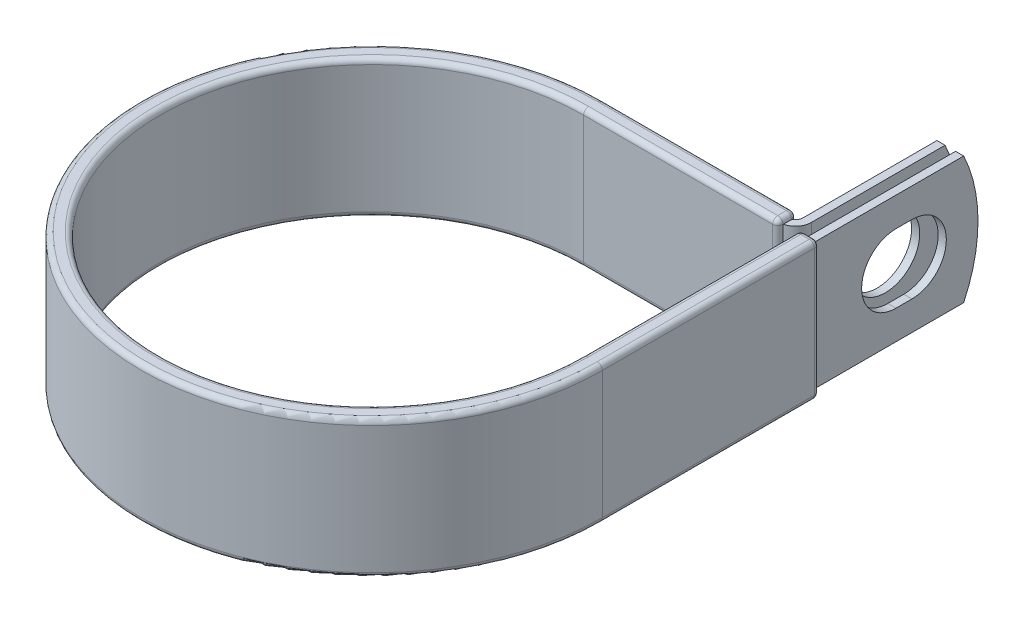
SolidWorks part; units mm, degrees
ref_plane "Front Plane" through (0, 0, 0) normal (0, 0, 1) x (1, 0, 0)
ref_plane "Top Plane" through (0, 0, 0) normal (0, 1, 0) x (1, 0, 0)
ref_plane "Right Plane" through (0, 0, 0) normal (1, 0, 0) x (0, 0, -1)
sketch "Sketch1" plane through (0, 0, 0) normal (0, 1, 0) x (1, 0, 0)
  line L0 (0, 32.5437) -> (28.5915, 32.5437)
  line L1 (32.5437, 0) -> (32.5437, 32.5437)
  line L2 (30.9689, 57.1246) -> (30.9689, 34.9212)
  line L5 (32.5437, 32.5437) -> (32.5437, 57.1246)
  arc A0 (0, 32.5437) -> (32.5437, 0) centre (0, 0) ccw
  arc A3 (28.5915, 32.5437) -> (30.9689, 34.9212) centre (28.5915, 34.9212) ccw
extrude "Extrude-Thin1" add sketch "Sketch1" along normal mid plane 19.05 thin
sketch "Sketch2" plane through (29.7498, 0, 0) normal (-1, 0, 0) x (0, 0, 1)
  line L0 (-57.1246, 9.525) -> (-57.1246, -9.525) construction
  line L7 (0, 9.525) -> (0, -9.525) construction
  circle A0 centre (-46.0248, 0) radius 5.1562
  point P2 (-57.1246, 0)
extrude "Cut-Extrude1" cut sketch "Sketch2" against normal up to surface (1.2192 mm away)
sketch "Sketch3" plane through (33.7629, 0, 0) normal (1, 0, 0) x (0, 0, -1)
  line L0 (44.831, 0) -> (47.2186, 0) construction
  line L1 (44.831, 5.1562) -> (47.2186, 5.1562)
  line L2 (44.831, -5.1562) -> (47.2186, -5.1562)
  line L3 (57.1246, 9.525) -> (57.1246, -9.525) construction
  arc A0 (44.831, 5.1562) -> (44.831, -5.1562) centre (44.831, 0) ccw
  arc A1 (47.2186, -5.1562) -> (47.2186, 5.1562) centre (47.2186, 0) ccw
  point P3 (46.0248, 0)
  point P8 (57.1246, 0)
  point P11 (39.6748, 0)
  point P12 (52.3748, 0)
extrude "Cut-Extrude2" cut sketch "Sketch3" against normal up to surface (1.2192 mm away)
sketch "Sketch4" plane through (29.7498, 0, 0) normal (-1, 0, 0) x (0, 0, 1)
  line L0 (-57.1246, 9.525) -> (-57.1246, -9.525)
  line L1 (-57.1246, 9.525) -> (-54.9801, 9.525)
  line L2 (-57.1246, 9.525) -> (-34.9212, 9.525) construction
  line L3 (-57.1246, -9.525) -> (-54.9801, -9.525)
  line L4 (-57.1246, -9.525) -> (-34.9212, -9.525) construction
  arc A0 (-54.9801, 9.525) -> (-54.9801, -9.525) centre (-34.8996, 0) ccw
extrude "Cut-Extrude3" cut sketch "Sketch4" against normal through all contours A0 M4 M5 | A0 L0 M2
ref_plane "Plane1" through (0, 0, -32.5437) normal (0, 0, 1) x (1, 0, 0)
ref_plane "Plane2" through (0, 0, 0) normal (-1, 0, 0) x (0, 0, 1)
sketch "Sketch5" plane through (0, 0, -32.5437) normal (0, 0, 1) x (1, 0, 0)
  line L0 (32.5437, 9.525) -> (33.7629, 9.525)
  line L1 (32.5437, -9.525) -> (32.5437, 9.525)
  line L2 (31.75, -9.5568) -> (31.75, 9.5567)
  line L3 (33.7629, 9.525) -> (33.7629, -9.525)
  line L4 (33.7629, -9.525) -> (32.5437, -9.525)
  line L5 (32.512, 10.3187) -> (33.7947, 10.3188)
  line L7 (34.5567, 9.5567) -> (34.5567, -9.5568)
  line L8 (33.7947, -10.3188) -> (32.512, -10.3188)
  line L9 (31.75, -10.3188) -> (31.75, 10.3187) construction
  line L11 (34.5567, -10.3188) -> (31.75, -10.3188) construction
  line L12 (34.5567, 10.3187) -> (34.5567, -10.3188) construction
  line L13 (31.75, 10.3187) -> (34.5567, 10.3187) construction
  arc A0 (31.75, -9.5568) -> (32.512, -10.3188) centre (32.512, -9.5568) ccw
  arc A1 (34.5567, -9.5568) -> (33.7947, -10.3188) centre (33.7947, -9.5568) cw
  arc A2 (31.75, 9.5567) -> (32.512, 10.3187) centre (32.512, 9.5567) cw
  arc A3 (33.7947, 10.3188) -> (34.5567, 9.5567) centre (33.7947, 9.5567) cw
sketch "Sketch6" plane through (0, 9.525, 0) normal (0, 1, 0) x (1, 0, 0)
  line L0 (31.75, 0) -> (31.75, 32.5437)
  line L1 (0, 31.75) -> (29.1147, 31.75)
  line L2 (29.7497, 54.9801) -> (29.7497, 34.9212) construction
  arc A0 (0, 31.75) -> (31.75, 0) centre (0, 0) ccw
sweep "Sweep1" add profiles "Sketch5" path "Sketch6"
fillet "Fillet1" radius 0.762 16 edges at (29.1148, 10.0956, -34.3335) (29.1148, 0, -34.5567) (29.1148, -10.0956, -34.3335) (29.1148, -10.3188, -33.1533) (29.1148, -10.0956, -31.9732) (29.1148, 0, -31.75) (29.1148, 10.0956, -31.9732) (34.3335, 10.0956, -32.5437) (34.5567, 0, -32.5437) (34.3335, -10.0956, -32.5437) (33.1533, -10.3188, -32.5437) (31.9732, -10.0956, -32.5437) (31.75, 0, -32.5437) (31.9732, 10.0956, -32.5437) (29.1148, 10.3187, -33.1533) (33.1533, 10.3187, -32.5437)
equation "\"D4@Sketch5\" = \"D1@Extrude-Thin1\""
equation "\"D5@Sketch5\" = \"D5@Extrude-Thin1\""
equation "\"D1@Sketch3\" = \"D2@Sketch2\""
equation "\"D7@Sketch1\" = \"D3@Sketch2\" + \"D1@Sketch3\""
equation "\"D1@Sketch1\" = \"D1@Sketch6\" + 2 * \"D3@Sketch5\""
equation "\"D1@Sketch4\" = ( \"D1@Extrude-Thin1\" + .125 ) * 2"
equation "\"D2@Sketch1\"=1.95*\"D5@Extrude-Thin1\""
equation "\"D2@Sketch3\" = \"D1@Sketch2\""
